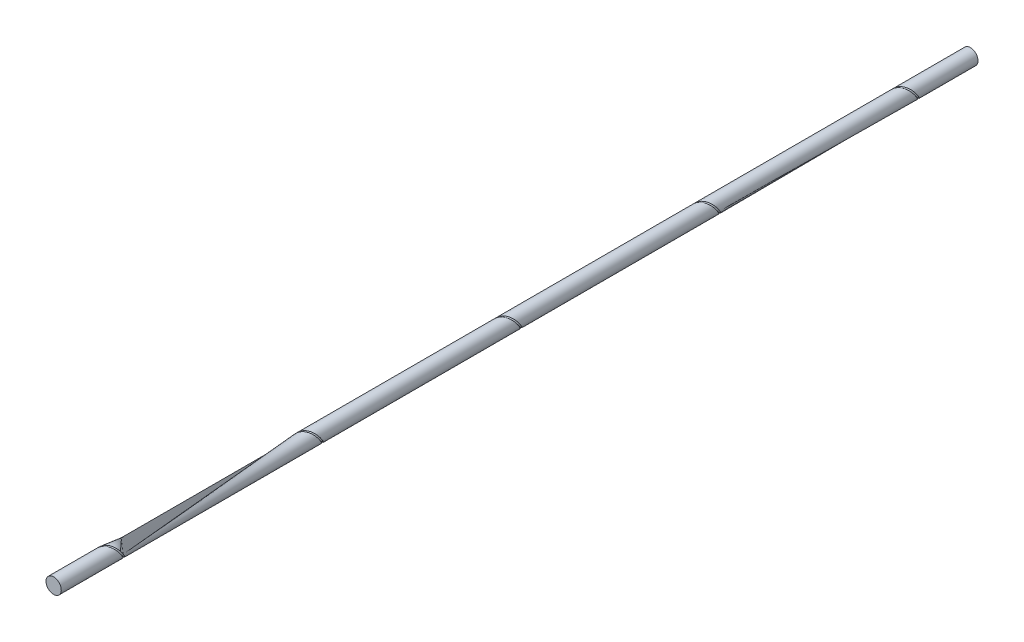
SolidWorks part; units mm, degrees
ref_plane "Front Plane" through (0, 0, 0) normal (0, 0, 1) x (1, 0, 0)
ref_plane "Top Plane" through (0, 0, 0) normal (0, 1, 0) x (1, 0, 0)
ref_plane "Right Plane" through (0, 0, 0) normal (1, 0, 0) x (0, 0, -1)
sketch "Sketch1" plane through (0, 0, 0) normal (0, 0, 1) x (1, 0, 0)
  circle A0 centre (0, 0) radius 25
  dimension "D1" = 50
extrude "Boss-Extrude1" add sketch "Sketch1" along normal blind 3000
ref_plane "Plane1" through (0, 0, 150) normal (0, 0, 1) x (1, 0, 0)
sketch "Sketch2" plane through (0, 0, 150) normal (0, 0, 1) x (1, 0, 0)
  circle A0 centre (0, 0) radius 27.646
  dimension "D1" = 55.292
curve "Helix/Spiral1"
sketch "Sketch3" plane through (0, 0, 0) normal (0, 1, 0) x (1, 0, 0)
  circle A0 centre (-27.646, -150) radius 3.969
  spline S0 degree 3 poles (-27.646, -150) (-27.646, -151.3307) (-27.0608, -154.0012) (-24.4828, -157.9997) (-20.3663, -162.0001) (-14.9702, -166) (-8.6335, -170) (-1.7543, -174) (5.2352, -178) (11.8957, -182) (17.8087, -186) (22.6028, -190) (25.9766, -194) (27.7183, -198) (27.7183, -202) (25.9766, -206) (22.6028, -210) (17.8087, -214) (11.8957, -218) (5.2352, -222) (-1.7543, -226) (-8.6335, -230) (-14.9702, -234) (-20.3663, -237.9999) (-24.4828, -242.0003) (-27.0608, -245.9988) (-27.646, -248.6693) (-27.646, -250) knots 0 0 0 0 0.04 0.08 0.12 0.16 0.2 0.24 0.28 0.32 0.36 0.4 0.44 0.48 0.52 0.56 0.6 0.64 0.68 0.72 0.76 0.8 0.84 0.88 0.92 0.96 1 1 1 1 construction
  dimension "D1" = 7.938
sweep "Cut-Sweep1" cut profiles "Sketch3" path "Helix/Spiral1"
pattern_linear "LPattern1" count 5 spacing 650 along (0, 0, -1) of "Cut-Sweep1"
